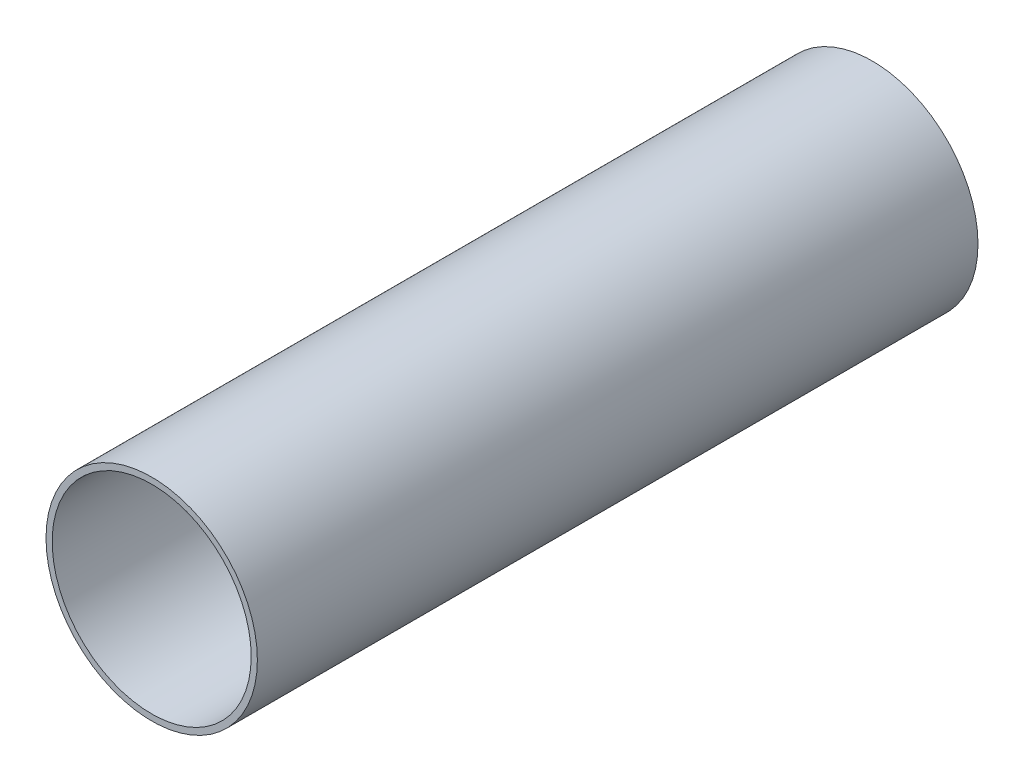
SolidWorks part; units mm, degrees
ref_plane "正面" through (0, 0, 0) normal (0, 0, 1) x (1, 0, 0)
ref_plane "平面" through (0, 0, 0) normal (0, 1, 0) x (1, 0, 0)
ref_plane "右側面" through (0, 0, 0) normal (1, 0, 0) x (0, 0, -1)
sketch "ｽｹｯﾁ1" plane through (0, 0, 0) normal (0, 0, 1) x (1, 0, 0)
  circle A0 centre (0, 0) radius 30.065
extrude "ﾎﾞｽ - 押し出し1" add sketch "ｽｹｯﾁ1" along normal blind 205
sketch "ｽｹｯﾁ2" plane through (0, 0, 205) normal (0, 0, 1) x (1, 0, 0)
  circle A0 centre (0, 0) radius 28.31
extrude "ｶｯﾄ - 押し出し1" cut sketch "ｽｹｯﾁ2" against normal through all
